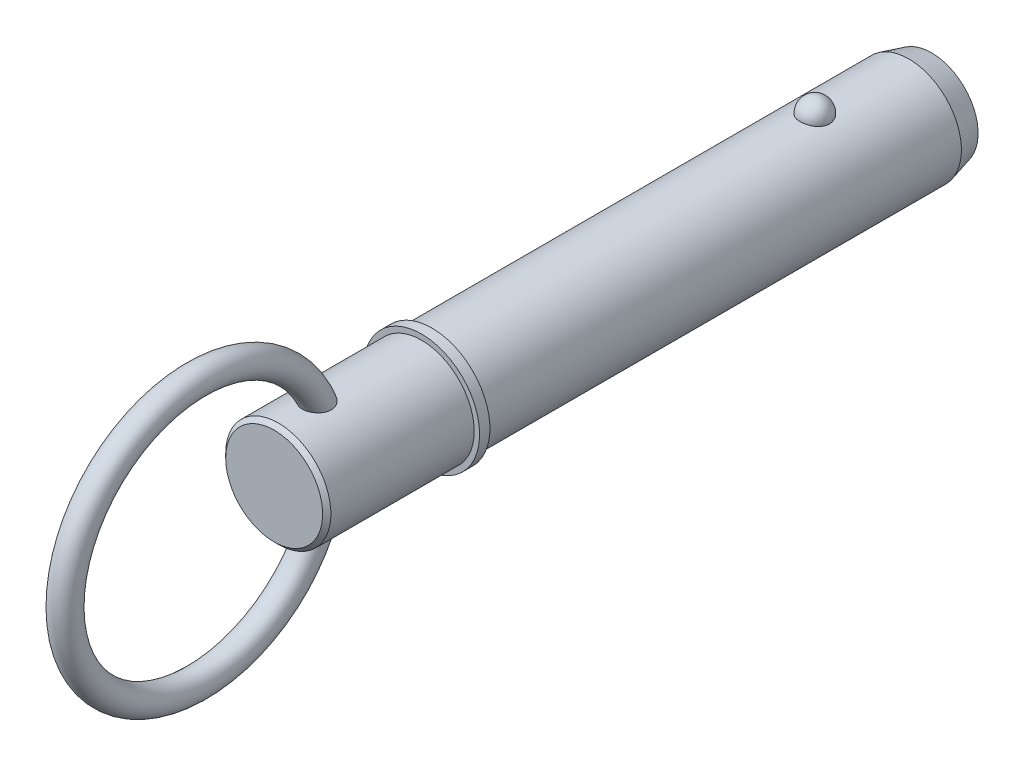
SolidWorks part; units mm, degrees
ref_plane "Front Plane" through (0, 0, 0) normal (0, 0, 1) x (1, 0, 0)
ref_plane "Top Plane" through (0, 0, 0) normal (0, 1, 0) x (1, 0, 0)
ref_plane "Right Plane" through (0, 0, 0) normal (1, 0, 0) x (0, 0, -1)
sketch "Sketch2" plane through (0, 0, 0) normal (0, 0, 1) x (1, 0, 0)
  circle A0 centre (0, 0) radius 12.7
  point P3 (0, 12.7)
  dimension "D1" = 25.4
extrude "Boss-Extrude1" add sketch "Sketch2" along normal blind 88.9
sketch "Sketch3" plane through (0, 0, 0) normal (0, 0, -1) x (-1, 0, 0)
  circle A0 centre (0, 0) radius 12.7
  dimension "D1" = 25.4
extrude "Boss-Extrude2" add sketch "Sketch3" along normal blind 31.75
chamfer "Chamfer1" distance 5.5 angle 15 1 edges at (-12.7, 0, -31.75)
sketch "Sketch18" plane through (0, 0, 0) normal (1, 0, 0) x (0, 0, -1)
  line L0 (26.25, 12.7) -> (-88.9, 12.7) construction
  line L1 (3.56, 16.26) -> (3.56, 9.14)
  line L2 (-88.9, -12.7) -> (26.25, -12.7) construction
  arc A0 (3.56, 16.26) -> (3.56, 9.14) centre (3.56, 12.7) ccw
  point P4 (0, 12.7)
  dimension "D1" = 28.96
revolve "Revolve1" add sketch "Sketch18" angle 360 about L1
sketch "Sketch19" plane through (0, 0, 0) normal (1, 0, 0) x (0, 0, -1)
  line L0 (-33.7288, 0) -> (-46.4542, 0) construction
sketch "Sketch20" plane through (0, 0, 0) normal (1, 0, 0) x (0, 0, -1)
  line L0 (-88.9, 0) -> (-88.9, 14)
  line L1 (-88.9, 12.7) -> (-88.9, -12.7) construction
  line L2 (-88.9, 14) -> (-91.4, 14)
  line L3 (-91.4, 14) -> (-91.4, 0)
  line L4 (-33.7288, 0) -> (-46.4542, 0) construction
  line L5 (-91.4, 0) -> (-88.9, 0)
  dimension "D1" = 14
  dimension "D2" = 2.5
revolve "Revolve2" add sketch "Sketch20" angle 360 about L0
sketch "Sketch21" plane through (0, 0, 88.9) normal (0, 0, -1) x (-1, 0, 0)
  circle A0 centre (0, 0) radius 12.7
  dimension "D1" = 25.4
extrude "Boss-Extrude3" add sketch "Sketch21" against normal blind 38.1
chamfer "Chamfer2" distance 1 angle 45 1 edges at (-12.7, 0, 127)
sketch "Sketch23" plane through (0, 0, 0) normal (1, 0, 0) x (0, 0, -1)
  line L0 (-127, 11.7) -> (-127, -11.7) construction
  circle A0 centre (-145.75, 0) radius 31.75
  point P2 (-114, 0)
  dimension "D1" = 63.5
  dimension "D2" = 13
sketch "Sketch24" plane through (0, 0, 0) normal (0, 1, 0) x (1, 0, 0)
  circle A0 centre (0, -114) radius 3.25
  dimension "D1" = 6.5
sweep "Sweep1" add profiles "Sketch24" path "Sketch23"
